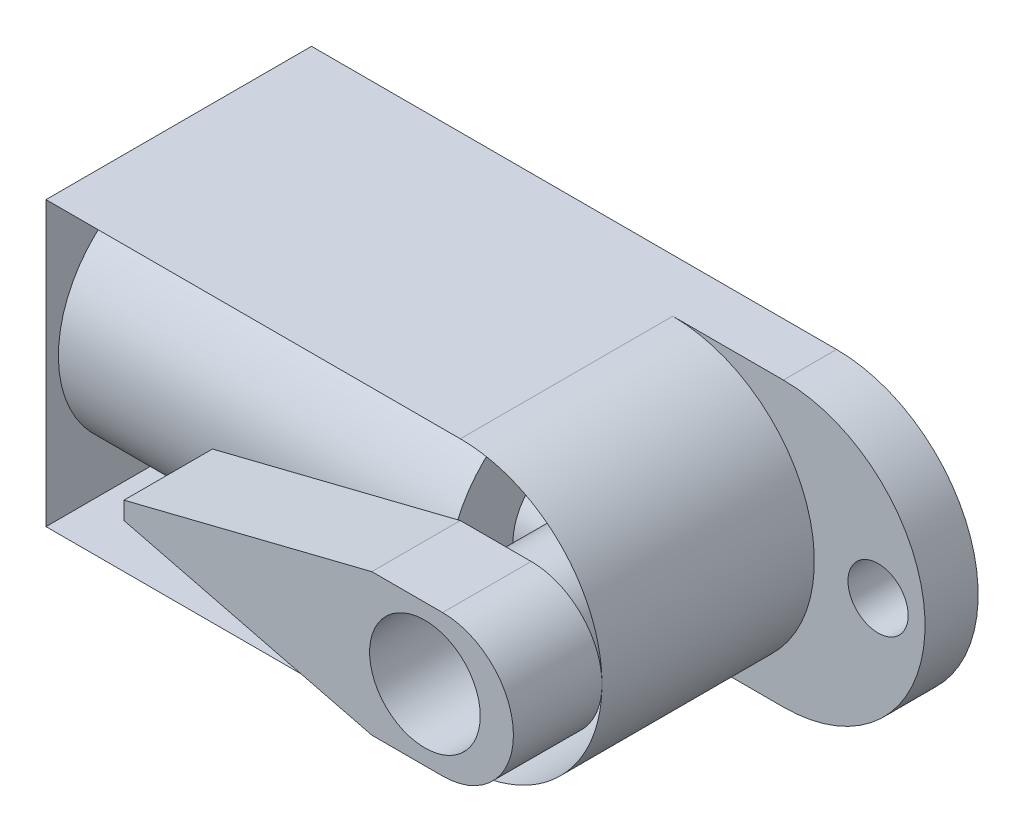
SolidWorks part; units mm, degrees
ref_plane "Plane1" through (0, 0, 0) normal (0, 0, 1) x (1, 0, 0)
ref_plane "Plane2" through (0, 0, 0) normal (0, 1, 0) x (1, 0, 0)
ref_plane "Plane3" through (0, 0, 0) normal (1, 0, 0) x (0, 0, -1)
sketch "Sketch1" plane through (0, 0, 0) normal (0, 0, 1) x (1, 0, 0)
  line L0 (-25.4, 10.16) -> (25.7226, 10.16) construction
  line L1 (25.7226, 0) -> (5.4026, 0)
  line L2 (-11.9456, 20.32) -> (-11.9456, 0)
  line L3 (5.4026, 0) -> (-11.9456, 0)
  line L4 (5.4026, 20.32) -> (-11.9456, 20.32)
  line L5 (25.7226, 20.32) -> (5.4026, 20.32)
  arc A0 (25.7226, 20.32) -> (25.7226, 0) centre (25.7226, 10.16) cw
  point P9 (-11.9456, 10.16)
  dimension "D1" = 10.16
  dimension "D2" = 20.32
  dimension "D3" = 17.3482
  dimension "D4" = 20.32
extrude "Base-Extrude" add sketch "Sketch1" along normal blind 25.4
sketch "Sketch4" plane through (0, 0, 0) normal (0, 0, -1) x (-1, 0, 0)
  line L0 (-25.7226, 10.16) -> (0, 10.16) construction
  circle A0 centre (-21.59, 10.16) radius 1.27
  circle A1 centre (-32.512, 10.16) radius 2.159
  dimension "D1" = 2.54
  dimension "D2" = 21.59
  dimension "D3" = 4.318
  dimension "D4" = 10.922
extrude "vertical_thru" cut sketch "Sketch4" against normal blind 50.8
sketch "Sketch5" plane through (-11.9456, 0, 0) normal (-1, 0, 0) x (0, 0, 1)
  line L0 (0, 10.16) -> (9.525, 10.16) construction
  line L1 (25.4, 10.16) -> (0, 10.16) construction
  circle A0 centre (9.525, 10.16) radius 3.9687
  dimension "D2" = 7.9375
  dimension "D1" = 9.525
extrude "horizontal_thru" cut sketch "Sketch5" against normal blind 33.528
sketch "Sketch6" plane through (-11.9456, 0, 0) normal (-1, 0, 0) x (0, 0, 1)
  line L0 (25.4, 10.16) -> (0, 10.16) construction
  circle A0 centre (9.525, 10.16) radius 8.636
  circle A1 centre (9.525, 10.16) radius 3.9687 construction
  dimension "D1" = 17.272
extrude "tbt_cbore" cut sketch "Sketch6" against normal blind 27.94
sketch "Sketch8" plane through (0, 0, 25.4) normal (0, 0, 1) x (1, 0, 0)
  line L0 (21.5824, 10.16) -> (15.9944, 10.16) construction
  circle A0 centre (21.59, 10.16) radius 3.9688
  dimension "D1" = 7.9375
  dimension "D2" = 21.59
extrude "vertical_cbore" cut sketch "Sketch8" against normal blind 19.558
sketch "Sketch9" plane through (0, 0, 25.4) normal (0, 0, 1) x (1, 0, 0)
  line L0 (22.86, 10.16) -> (-15.2372, 10.16) construction
  line L1 (21.5824, 10.16) -> (15.9944, 10.16) construction
  line L2 (17.78, 15.24) -> (22.86, 15.24)
  line L3 (17.78, 5.08) -> (22.86, 5.08)
  line L6 (17.78, 15.24) -> (0, 10.795)
  line L7 (0, 10.795) -> (0, 9.525)
  line L8 (17.78, 5.08) -> (0, 9.525)
  arc A0 (22.86, 15.24) -> (22.86, 5.08) centre (22.86, 10.16) cw
  circle A1 centre (21.59, 10.16) radius 1.27 construction
  circle A2 centre (32.512, 10.16) radius 2.159 construction
  point P14 (0, 10.16)
  dimension "D4" = 1.27
  dimension "D5" = 9.652
  dimension "D1" = 5.08
  dimension "D2" = 0.635
  dimension "D3" = 17.78
extrude "sail_cut" cut sketch "Sketch9" against normal blind 6.35 flip side to cut
sketch "Sketch10" plane through (0, 0, 19.05) normal (0, 0, 1) x (1, 0, 0)
  line L0 (22.86, 10.16) -> (43.18, 10.16) construction
  line L1 (17.78, 10.16) -> (17.78, 20.32) construction
  line L3 (25.4, 10.16) -> (17.78, 10.16) construction
  line L4 (25.7226, 20.32) -> (-11.9456, 20.32) construction
  line L5 (17.78, 20.32) -> (17.78, 22.86)
  line L6 (17.78, 22.86) -> (40.64, 22.86)
  line L7 (40.64, 22.86) -> (40.64, -2.54)
  line L8 (40.64, -2.54) -> (17.78, -2.54)
  line L9 (17.78, -2.54) -> (17.78, 0)
  circle A0 centre (21.59, 10.16) radius 1.27 construction
  arc A2 (17.78, 0) -> (17.78, 20.32) centre (17.78, 10.16) ccw
  dimension "D2" = 5.08
extrude "Cut-Extrude6" cut sketch "Sketch10" against normal blind 15.24
fillet "Fillet2" radius 2.54 1 edges at (25.5587, 10.16, 5.842)
